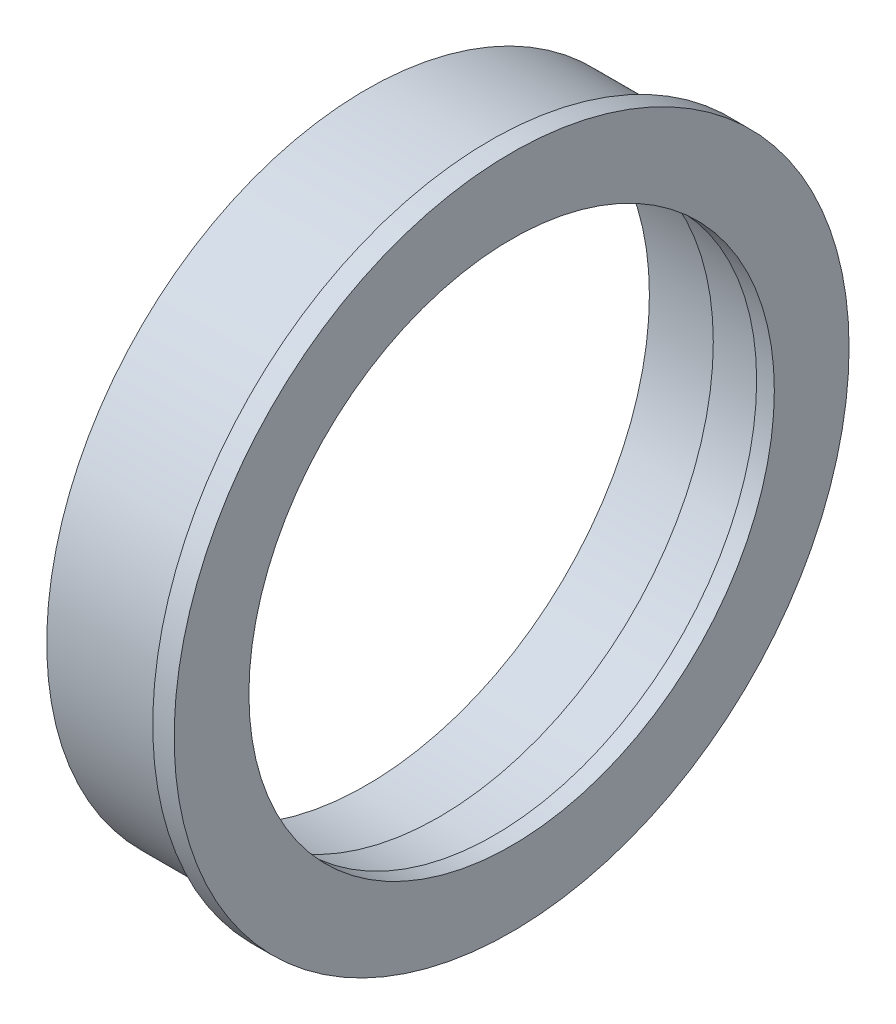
SolidWorks part; units mm, degrees
ref_plane "Front Plane" through (0, 0, 0) normal (0, 0, 1) x (1, 0, 0)
ref_plane "Top Plane" through (0, 0, 0) normal (0, 1, 0) x (1, 0, 0)
ref_plane "Right Plane" through (0, 0, 0) normal (1, 0, 0) x (0, 0, -1)
sketch "Sketch1" plane through (0, 0, 0) normal (0, 0, 1) x (1, 0, 0)
  line L0 (4.2543, 0) -> (-16.8843, 0) construction
  line L3 (0.0439, 31.85) -> (-6.3339, 31.85)
  line L4 (0.0439, 30.5062) -> (2.0973, 30.5062)
  line L5 (2.0973, 30.5062) -> (2.0973, 39.1839)
  line L6 (2.0973, 39.1839) -> (-0.3888, 39.1839)
  line L7 (-0.3888, 39.1839) -> (-0.3888, 37.0907)
  line L8 (-0.3888, 37.0907) -> (-14.7919, 37.0907)
  line L9 (-14.7919, 37.0907) -> (-14.7919, 32.8873)
  line L10 (-14.7919, 32.8873) -> (-6.3339, 32.8873)
  line L11 (-6.3339, 32.8873) -> (-6.3339, 31.85)
  line L12 (0.0439, 30.5062) -> (0.0439, 31.85)
  line L13 (-6.3339, 31.85) -> (-6.3219, 31.8294)
  dimension "D1" = 74.1815
  dimension "D2" = 78.3677
  dimension "D3" = 65.7746
  dimension "D4" = 63.7
  dimension "D5" = 61.0124
  dimension "D6" = 16.8891
  dimension "D7" = 14.403
  dimension "D8" = 14.8358
  dimension "D9" = 8.4699
revolve "Revolve1" add sketch "Sketch1" angle 360 about L0
